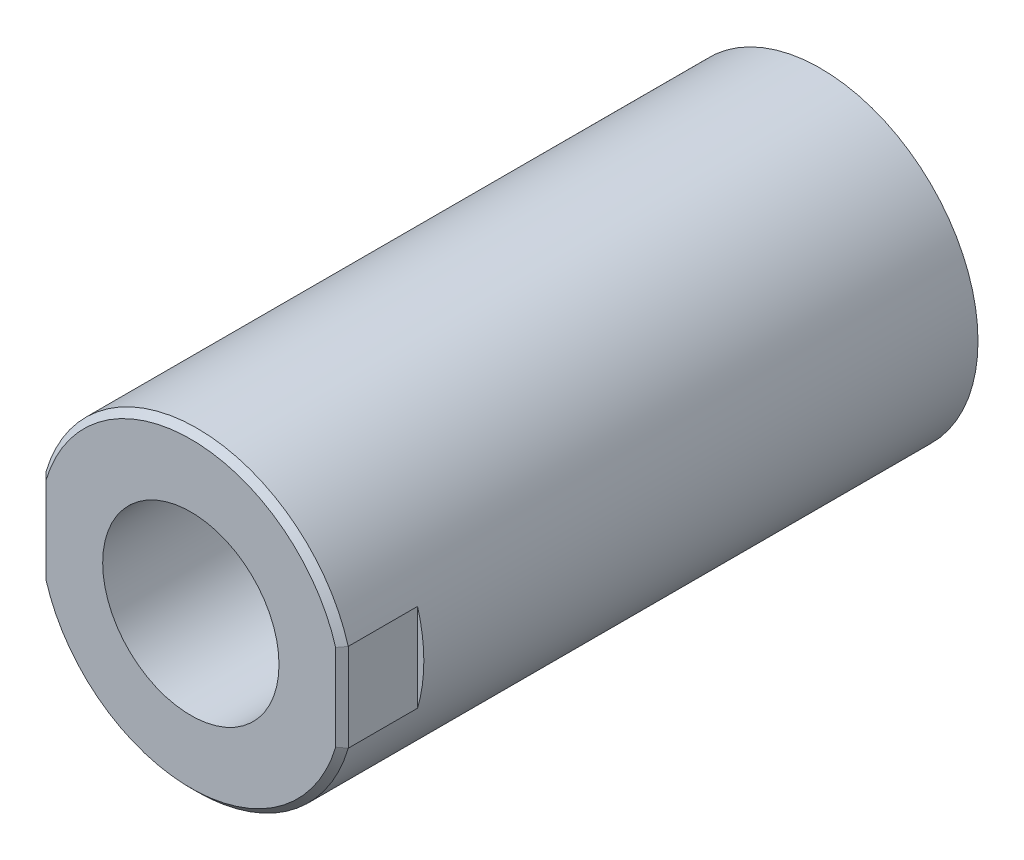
SolidWorks part; units mm, degrees
ref_plane "Front Plane" through (0, 0, 0) normal (0, 0, 1) x (1, 0, 0)
ref_plane "Top Plane" through (0, 0, 0) normal (0, 1, 0) x (1, 0, 0)
ref_plane "Right Plane" through (0, 0, 0) normal (1, 0, 0) x (0, 0, -1)
sketch "Sketch1" plane through (0, 0, 0) normal (0, 0, 1) x (1, 0, 0)
  circle A0 centre (0, 0) radius 25
  dimension "D1" = 50
extrude "S" add sketch "Sketch1" against normal blind 100
sketch "Sketch2" plane through (0, 0, 0) normal (0, 0, 1) x (1, 0, 0)
  circle A0 centre (0, 0) radius 25
  circle A1 centre (0, 0) radius 25 construction
  dimension "D1" = 50
extrude "L2" add sketch "Sketch2" along normal blind 15
hole_wizard "( T1xL4 ) M30x1.5 Tapped Hole1 " positions "3DSketch1" profile "Sketch5" tap size "M30x2.0" standard "Ansi Metric"
sketch3d "3DSketch1"
  circle A0 centre (0, 0, 15) radius 25 construction
  point P0 (0, 0, 15)
  point P5 (0, 0, 40)
sketch "Sketch5" plane through (0, 0, 15) normal (1, 0, 0) x (0, -1, 0)
  line L0 (0, 0) -> (0, 74.412)
  line L1 (0, 74.412) -> (14, 66)
  line L2 (14, 66) -> (14, 0)
  line L5 (14, 0) -> (0, 0)
  line L10 (0, 74.412) -> (-14, 66) construction
  line L11 (0, -6.35) -> (0, 107.95) construction
  dimension "Tap Drill Dia." = 28
  dimension "Tap Drill Depth" = 66
  dimension "Drill Angle" = 118
chamfer "Chamfer2" distance 0.5 angle 45 1 edges at (25, 0, 15)
sketch "Sketch6" plane through (0, 0, 0) normal (0, 0, 1) x (1, 0, 0)
  circle A0 centre (0, 0) radius 24.5
  circle A1 centre (0, 0) radius 25
  circle A2 centre (0, 0) radius 25 construction
  circle A4 centre (0, 0) radius 25 construction
  dimension "D1" = 50
  dimension "D2" = 49
  dimension "D3" = 50
extrude "U/C" cut sketch "Sketch6" along normal blind 1
sketch "Sketch7" plane through (0, 0, 0) normal (0, 1, 0) x (1, 0, 0)
  line L1 (24, 0) -> (26.5, 0)
  line L2 (24, 0) -> (24, 12)
  line L3 (24, 12) -> (26.5, 12)
  line L4 (26.5, 0) -> (26.5, 12)
  line L5 (-26.5, 0) -> (-24, 0)
  line L6 (-26.5, 0) -> (-26.5, 12)
  line L7 (-26.5, 12) -> (-24, 12)
  line L8 (-24, 0) -> (-24, 12)
  line L12 (0, -1) -> (0, -14.5) construction
  line L13 (-25, 100) -> (25, 100) construction
  line L14 (0, 0) -> (0, -15) construction
  line L15 (0, 51) -> (0, -15) construction
  line L16 (-24.5, -15) -> (24.5, -15) construction
  dimension "D1" = 12
  dimension "D2" = 48
  dimension "D3" = 24
  dimension "D4" = 53
  dimension "D5" = 26.5
  dimension "D6" = 50
  dimension "D7" = 15
extrude "A/F" cut sketch "Sketch7" against normal mid plane 21
sketch "Sketch8" plane through (0, 0, 0) normal (0, 1, 0) x (1, 0, 0)
  line L1 (-31.0859, 0) -> (29.3393, 0)
  line L2 (-31.0859, 0) -> (-31.0859, -16.6714)
  line L3 (-31.0859, -16.6714) -> (29.3393, -16.6714)
  line L4 (29.3393, 0) -> (29.3393, -16.6714)
extrude "Cut-Extrude1" cut sketch "Sketch8" against normal mid plane 60
chamfer "Chamfer3" distance 1 angle 45 4 edges at (24, 0, 0) (0, 25, 0) (0, -25, 0) (-24, 0, 0)
equation "\"D2@Sketch6\" =\"D3@Sketch6\" - 1"
equation "\"D1@Sketch6\" = \"D3@Sketch6\""
equation "\"D2@Sketch7\" = \"D6@Sketch7\" - 2"
equation "\"D3@Sketch7\" = \"D2@Sketch7\" / 2"
equation "\"D4@Sketch7\" = \"D2@Sketch7\"+5"
equation "\"D5@Sketch7\" = \"D4@Sketch7\"/2"
equation "\"D1@Sketch7\" = \"D7@Sketch7\"-3"
